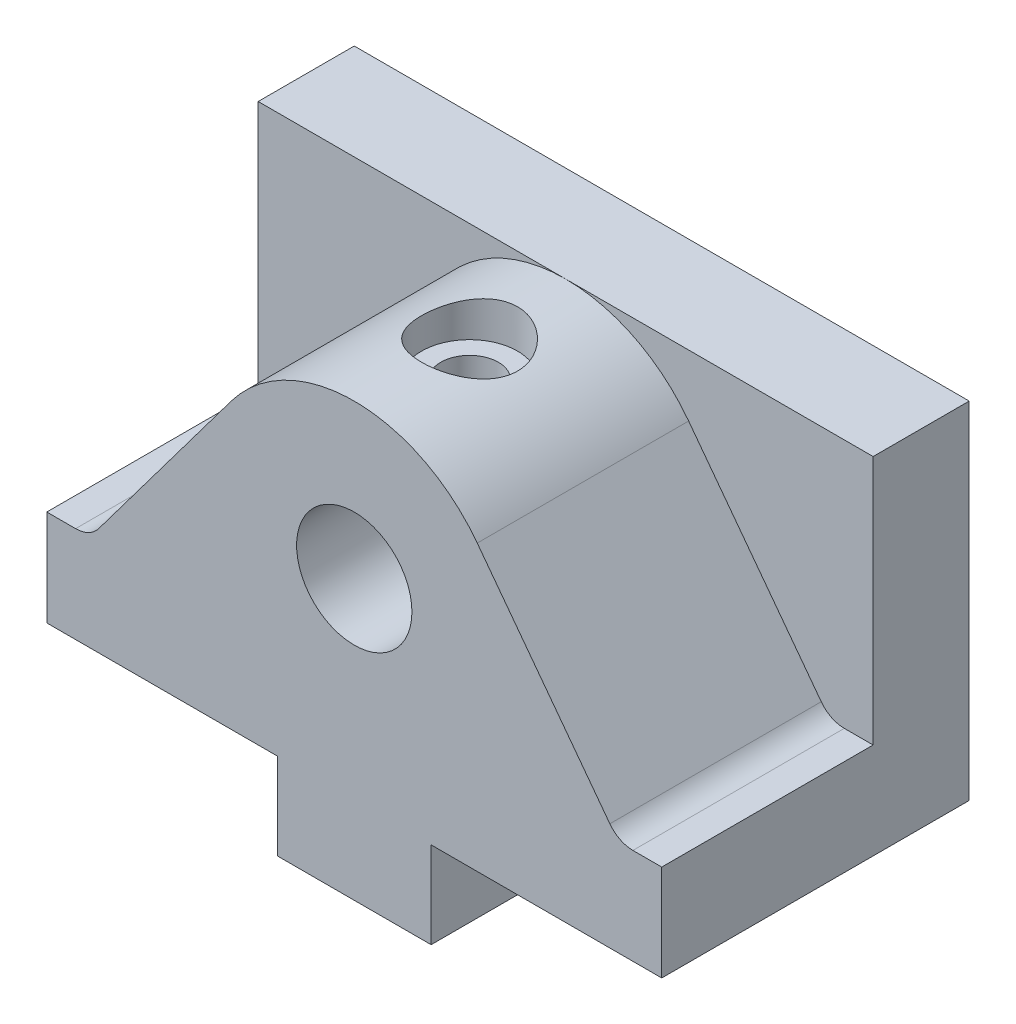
SolidWorks part; units mm, degrees
ref_plane "Front Plane" through (0, 0, 0) normal (0, 0, 1) x (1, 0, 0)
ref_plane "Top Plane" through (0, 0, 0) normal (0, 1, 0) x (1, 0, 0)
ref_plane "Right Plane" through (0, 0, 0) normal (1, 0, 0) x (0, 0, -1)
sketch "Sketch1" plane through (0, 0, 0) normal (0, 0, 1) x (1, 0, 0)
  line L0 (-32, 0) -> (-8, 0)
  line L1 (32, 0) -> (32, 10)
  line L2 (32, 10) -> (27.5, 10)
  line L3 (27.5, 10) -> (12.8, 29.6)
  line L4 (-12.8, 29.6) -> (-27.5, 10)
  line L5 (-27.5, 10) -> (-32, 10)
  line L6 (-32, 10) -> (-32, 0)
  line L7 (-8, 0) -> (-8, -9)
  line L8 (-8, -9) -> (8, -9)
  line L9 (8, -9) -> (8, 0)
  line L10 (8, 0) -> (32, 0)
  line L11 (0, 0) -> (0, -9) construction
  arc A0 (12.8, 29.6) -> (-12.8, 29.6) centre (0, 20) ccw
  point P0 (0, -9)
  dimension "D6" = 16
  dimension "D1" = 16
  dimension "D2" = 55
  dimension "D3" = 64
  dimension "D4" = 9
  dimension "D5" = 10
  dimension "D7" = 20
extrude "Extrude1" add sketch "Sketch1" along normal blind 22
sketch "Sketch2" plane through (0, 0, 0) normal (0, 0, -1) x (-1, 0, 0)
  line L0 (32, 10) -> (32, 0) construction
  line L1 (-32, 0) -> (-8, 0)
  line L2 (-32, 0) -> (-32, 36)
  line L3 (-32, 36) -> (32, 36)
  line L4 (32, 0) -> (32, 36)
  line L5 (-8, 0) -> (-8, -9)
  line L6 (-8, -9) -> (8, -9)
  line L7 (8, -9) -> (8, 0)
  line L8 (8, 0) -> (32, 0)
  arc A0 (12.8, 29.6) -> (-12.8, 29.6) centre (0, 20) ccw construction
extrude "Extrude2" add sketch "Sketch2" along normal blind 10
fillet "Fillet1" radius 3 2 edges at (-27.5, 10, 11) (27.5, 10, 11)
other "Hole1" parameters "D1"=24
sketch "Sketch3" plane through (0, 0, 22) normal (0, 0, 1) x (1, 0, 0)
  circle A0 centre (0, 20) radius 6
  arc A1 (12.8, 29.6) -> (-12.8, 29.6) centre (0, 20) ccw construction
  dimension "D1" = 12
hole_wizard "CBORE for M6 SBHCS1" positions "3DSketch1" profile "Sketch4" counterbore size "M6" standard "Ansi Metric"
sketch3d "3DSketch1"
  line L0 (-32, 36, -10) -> (32, 36, -10) construction
  point P0 (0, 36, 10)
  dimension "D1" = 20
sketch "Sketch4" plane through (0, 36, 10) normal (1, 0, 0) x (0, 0, 1)
  line L0 (0, 0) -> (0, 10)
  line L1 (0, 10) -> (3, 10)
  line L3 (3, 10) -> (3, 4)
  line L4 (3, 4) -> (5, 4)
  line L5 (5, 4) -> (5, 0)
  line L7 (5, 0) -> (0, 0)
  line L11 (0, -6.35) -> (0, 107.95) construction
  dimension "Thru Hole Dia." = 6
  dimension "Thru Hole Depth" = 10
  dimension "C'Bore Dia." = 10
  dimension "C'Bore Depth" = 4
hole_wizard "Ø6.0 (6) Diameter Hole1" positions "3DSketch3" profile "Sketch6" hole size "Ø6.0" standard "Ansi Metric"
sketch3d "3DSketch3"
  line L0 (-8, -9, 22) -> (8, -9, 22) construction
  point P0 (0, -9, 14)
  point P2 (0, -9, -2)
  point P10 (0, -9, 22)
  dimension "D1" = 8
  dimension "D2" = 16
sketch "Sketch6" plane through (0, -9, 14) normal (1, 0, 0) x (0, 0, -1)
  line L0 (0, 0) -> (0, 17.8026)
  line L1 (0, 17.8026) -> (3, 16)
  line L2 (3, 16) -> (3, 0)
  line L5 (3, 0) -> (0, 0)
  line L10 (0, 17.8026) -> (-3, 16) construction
  line L11 (0, -6.35) -> (0, 107.95) construction
  dimension "Hole Dia." = 6
  dimension "Hole Depth" = 16
  dimension "Drill Angle" = 118
